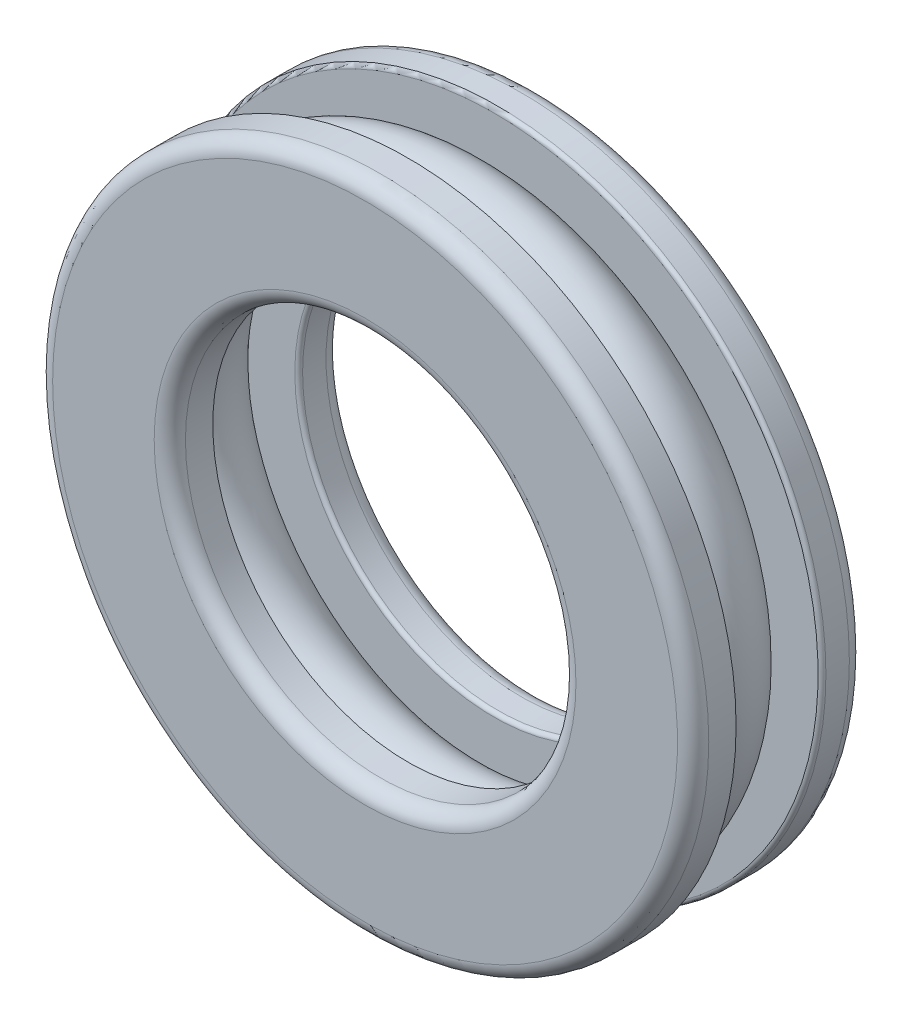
SolidWorks part; units mm, degrees
ref_plane "Спереди" through (0, 0, 0) normal (0, 0, 1) x (1, 0, 0)
ref_plane "Сверху" through (0, 0, 0) normal (0, 1, 0) x (1, 0, 0)
ref_plane "Справа" through (0, 0, 0) normal (1, 0, 0) x (0, 0, -1)
sketch "Эскиз1" plane through (0, 0, 0) normal (0, 1, 0) x (1, 0, 0)
  line L0 (0, 0) -> (0, 27.6874) construction
  line L1 (-21, 11) -> (-12.5, 0) construction
  line L2 (-21, 0) -> (-12.5, 0)
  line L3 (-21, 0) -> (-21, 2.75)
  line L4 (-21, 2.75) -> (-12.5, 2.75)
  line L5 (-12.5, 0) -> (-12.5, 2.75)
  line L6 (-21, 11) -> (-12.5, 11)
  line L7 (-21, 11) -> (-21, 8.25)
  line L8 (-21, 8.25) -> (-12.5, 8.25)
  line L9 (-12.5, 11) -> (-12.5, 8.25)
  line L10 (-21, 11) -> (-16.75, 5.5) construction
  line L11 (-16.75, 5.5) -> (-12.5, 11) construction
  circle A0 centre (-16.75, 5.5) radius 2.65
  point P13 (-16.75, 2.85)
  point P14 (-14.625, 8.25)
  dimension "D1" = 42
  dimension "D2" = 25
  dimension "D3" = 11
  dimension "D4" = 0.1
revolve "Повернуть1" add sketch "Эскиз1" angle 360 about L0
fillet "Скругление1" radius 1 2 edges at (21, 0, 0) (12.5, 0, 0)
fillet "Скругление2" radius 1 2 edges at (12.5, 0, -11) (21, 0, -11)
fillet "Скругление3" radius 0.25 2 edges at (21, 0, -8.25) (12.5, 0, -8.25)
